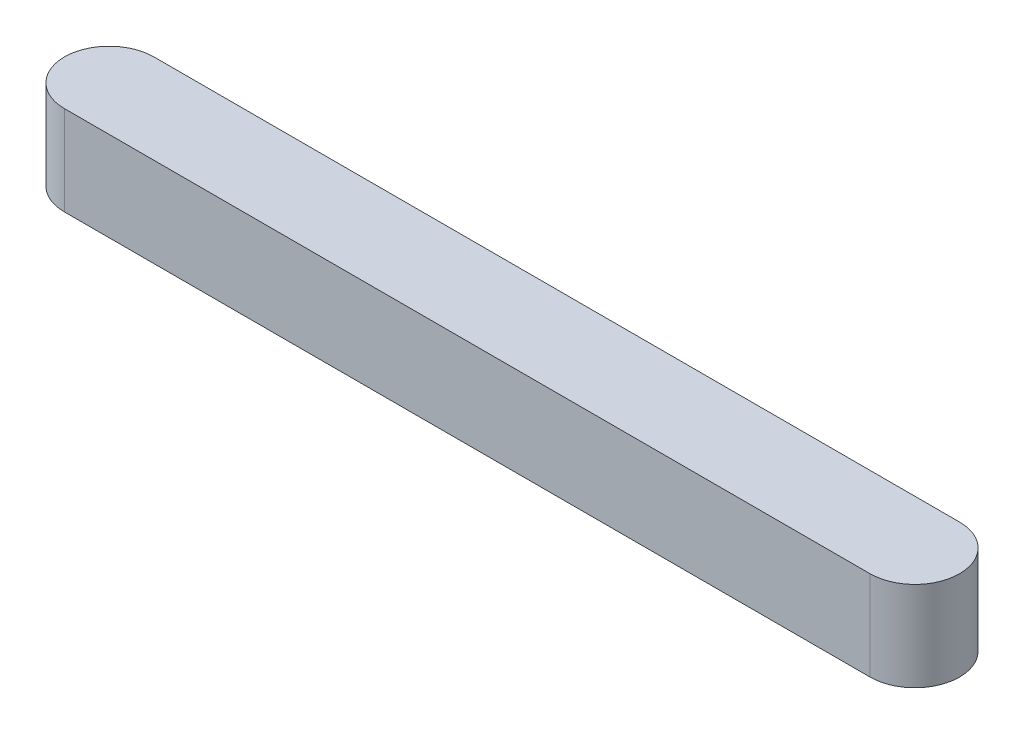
SolidWorks part; units mm, degrees
ref_plane "Front Plane" through (0, 0, 0) normal (0, 0, 1) x (1, 0, 0)
ref_plane "Top Plane" through (0, 0, 0) normal (0, 1, 0) x (1, 0, 0)
ref_plane "Right Plane" through (0, 0, 0) normal (1, 0, 0) x (0, 0, -1)
sketch "Sketch1" plane through (0, 0, 0) normal (0, 1, 0) x (1, 0, 0)
  line L0 (0, 0) -> (18, 0)
  line L1 (18, 2) -> (0, 2)
  arc A0 (18, 0) -> (18, 2) centre (18, 1) ccw
  arc A1 (0, 2) -> (0, 0) centre (0, 1) ccw
extrude "Boss-Extrude1" add sketch "Sketch1" along normal blind 2
equation "\"keywidth\"= 2mm"
equation "\"keyheigh\"= 2mm"
equation "\"facewidth\"= 20mm"
equation "\"D2@Sketch1\"= \"keywidth\""
equation "\"D1@Sketch1\"=\"facewidth\" -\"keywidth\""
equation "\"D1@Boss-Extrude1\"=\"keyheigh\""
